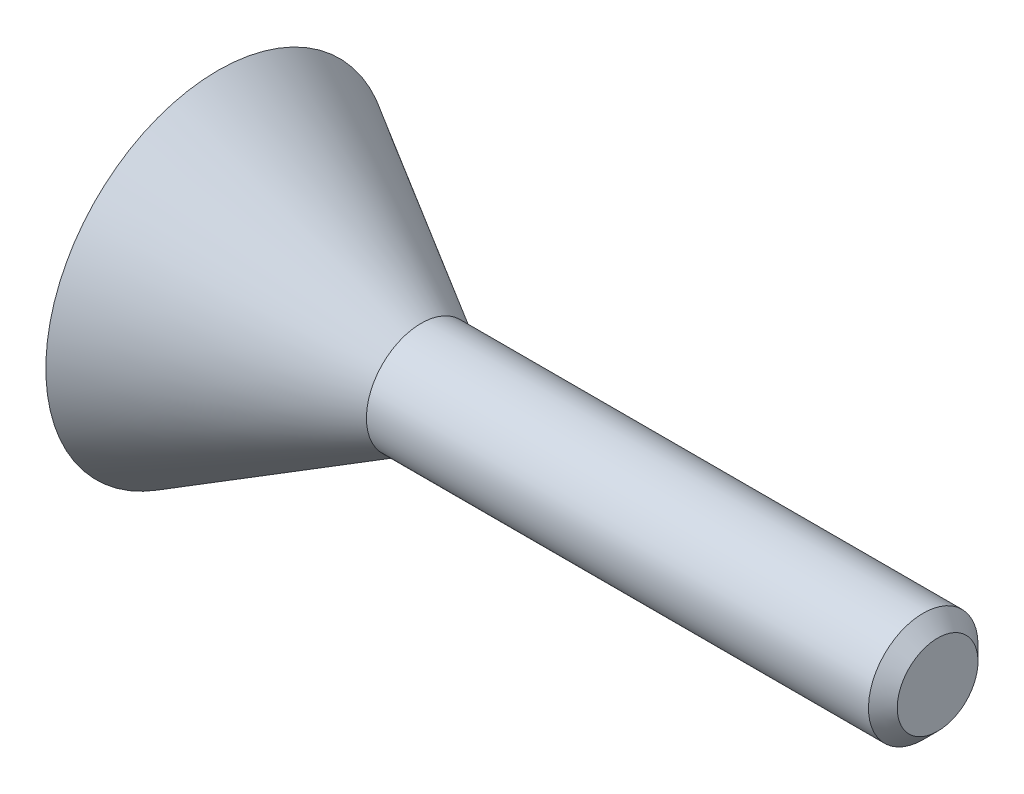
SolidWorks part; units mm, degrees
ref_plane "Front Plane" through (0, 0, 0) normal (0, 0, 1) x (1, 0, 0)
ref_plane "Top Plane" through (0, 0, 0) normal (0, 1, 0) x (1, 0, 0)
ref_plane "Right Plane" through (0, 0, 0) normal (1, 0, 0) x (0, 0, -1)
sketch "Sketch1" plane through (0, 0, 0) normal (1, 0, 0) x (0, 0, -1)
  circle A0 centre (0, 0) radius 5.5
  dimension "D1" = 11
extrude "Boss-Extrude1" add sketch "Sketch1" along normal mid plane 23 contours A0
sketch "Sketch2" plane through (0, 0, 0) normal (0, 0, 1) x (1, 0, 0)
  line L0 (-5.0048, 1.75) -> (11.5, 1.75)
  line L1 (11.5, -5.5) -> (11.5, 5.5) construction
  line L2 (11.5, 1.75) -> (11.5, 5.5)
  line L3 (-5.0048, 1.75) -> (-11.5, 5.5)
  line L4 (-11.5, 5.5) -> (11.5, 5.5)
  line L5 (-11.5, 5.5) -> (-11.5, -5.5) construction
  line L6 (-11.5, 0) -> (11.5, 0) construction
  dimension "D1" = 30
  dimension "D2" = 3.5
revolve "Cut-Revolve1" cut sketch "Sketch2" angle 360 about L6
sketch "Sketch3" plane through (-11.5, 0, 0) normal (-1, 0, 0) x (0, 0, 1)
  line L1 (0.42, 3.15) -> (0.42, -4.07)
  line L2 (1.01, 3.15) -> (0.42, 3.15)
  line L3 (0, 4.83) -> (1.01, 3.15)
  line L4 (0, 4.83) -> (-1.01, 3.15)
  line L5 (-1.01, 3.15) -> (-0.42, 3.15)
  line L6 (-0.42, 3.15) -> (-0.42, -4.07)
  line L7 (0, 5.5) -> (0, -5.5) construction
  arc A0 (-0.42, -4.07) -> (0.42, -4.07) centre (0, -4.07) ccw
  circle A1 centre (0, 0) radius 5.5 construction
  dimension "D6" = 0.84
  dimension "D2" = 1.01
  dimension "D3" = 2.02
  dimension "D1" = 0.67
  dimension "D5" = 1.68
extrude "Cut-Extrude1" cut sketch "Sketch3" against normal blind 0.6
chamfer "Chamfer1" distance 0.46 angle 45 1 edges at (11.5, -1.75, 0)
sketch "Sketch4" plane through (-11.5, 0, 0) normal (-1, 0, 0) x (0, 0, 1)
  text T0 "2  7" font "Bahnschrift" height 4
extrude "Cut-Extrude2" cut sketch "Sketch4" against normal blind 0.6
